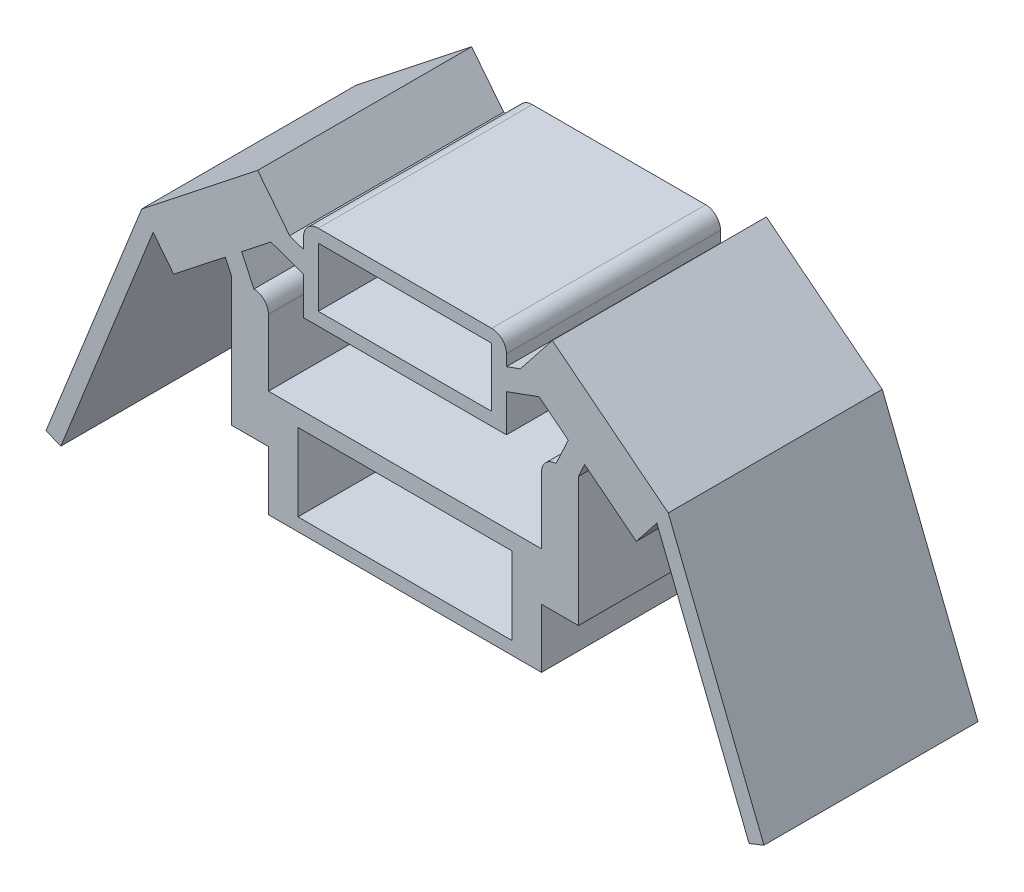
SolidWorks part; units mm, degrees
ref_plane "前视基准面" through (0, 0, 0) normal (0, 0, 1) x (1, 0, 0)
ref_plane "上视基准面" through (0, 0, 0) normal (0, 1, 0) x (1, 0, 0)
ref_plane "右视基准面" through (0, 0, 0) normal (1, 0, 0) x (0, 0, -1)
other "Configuration Table"
sketch "草图1" plane through (0, 0, 0) normal (0, 0, 1) x (1, 0, 0)
  line L0 (2.75, 5.2) -> (3.1259, 5.3368)
  line L1 (-3.7, -1.4) -> (3.7, -1.4)
  line L2 (-3.7, -1.4) -> (-3.7, 1.4)
  line L4 (3.7, -1.4) -> (3.7, 0.1)
  line L5 (-3.7, -1.4) -> (3.7, 1.4) construction
  line L6 (-3.7, 1.4) -> (3.7, -1.4) construction
  line L7 (-2.75, 5.2) -> (2.75, 5.2)
  line L8 (-2.75, 5.2) -> (-2.75, 3.6)
  line L9 (-2.75, 3.6) -> (2.75, 3.6)
  line L10 (2.75, 4.6147) -> (2.75, 3.6)
  line L11 (-2.75, 5.2) -> (2.75, 3.6) construction
  line L12 (-2.75, 3.6) -> (2.75, 5.2) construction
  line L14 (3.7, 0.1) -> (4.7, 0.1)
  line L17 (3.9926, 6.4362) -> (3.1259, 5.3368)
  line L19 (3.9926, 6.4362) -> (7.1338, 3.9598)
  line L33 (2.75, 5.2) -> (2.75, 4.6147) construction
  line L34 (3.1259, 5.3368) -> (3.6338, 4.9364) construction
  line L37 (4.7, 3.6) -> (4.7, 0.1)
  line L38 (-3.7, 1.4) -> (3.7, 1.4)
  line L39 (3.7, 1.4) -> (3.7, 0.1) construction
  line L40 (0, 9.062) -> (0, -4.0269) construction
  line L41 (2.75, 4.6147) -> (3.6338, 4.9364)
  line L48 (3.6338, 4.9364) -> (4.4253, 4.3124)
  line L51 (4.0931, 3.6) -> (4.4253, 4.3124)
  line L53 (4.869, 3.9625) -> (6.2671, 2.8603)
  line L55 (4.4253, 4.3124) -> (4.869, 3.9625) construction
  line L56 (4.0931, 3.6) -> (4.7, 3.6) construction
  line L57 (3.7, 1.4) -> (3.7, 3.6)
  line L58 (3.7, 3.6) -> (4.0931, 3.6)
  line L59 (4.7, 3.6) -> (4.869, 3.9625)
  line L60 (6.2671, 2.8603) -> (7.1338, 3.9598)
  point P0 (0, 0)
  point P6 (0, 4.4)
  dimension "D1" = 7.4
  dimension "D2" = 2.8
  dimension "D3" = 5.5
  dimension "D4" = 1.6
  dimension "D5" = 1
  dimension "D6" = 0.4
  dimension "D7" = 0.4
  dimension "D8" = 0.55
  dimension "D9" = 3.5
  dimension "D10" = 1.4
  dimension "D11" = 0.55
  dimension "D12" = 2.2
  dimension "D13" = 65
  dimension "D14" = 2.2
  dimension "D15" = 4
  dimension "D16" = 110
extrude "凸台-拉伸1" add sketch "草图1" along normal blind 5.8
mirror "镜向1" about plane through (0, 0, 0) normal (1, 0, 0) of "凸台-拉伸1"
sketch "草图10" plane through (0, 0, 5.8) normal (0, 0, 1) x (1, 0, 0)
  line L0 (-2.75, 3.6) -> (2.75, 3.6) construction
  line L1 (-2.9, -1.05) -> (2.9, -1.05)
  line L2 (-2.9, -1.05) -> (-2.9, 1.05)
  line L3 (-2.9, 1.05) -> (2.9, 1.05)
  line L4 (2.9, -1.05) -> (2.9, 1.05)
  line L5 (-2.9, -1.05) -> (2.9, 1.05) construction
  line L6 (-2.9, 1.05) -> (2.9, -1.05) construction
  line L7 (-2.35, 5.55) -> (2.35, 5.55)
  line L8 (-2.35, 5.55) -> (-2.35, 3.95)
  line L9 (-2.35, 3.95) -> (2.35, 3.95)
  line L10 (2.35, 5.55) -> (2.35, 3.95)
  point P0 (0, 0)
  point P10 (0, 5.55)
  dimension "D1" = 5.8
  dimension "D2" = 2.1
  dimension "D3" = 4.7
  dimension "D4" = 1.6
  dimension "D5" = 0.35
extrude "切除-拉伸3" cut sketch "草图10" against normal through all
sketch "草图11" plane through (0, 0, 5.8) normal (0, 0, 1) x (1, 0, 0)
  line L0 (-2.35, 5.2) -> (-2.75, 5.2)
  line L1 (-2.75, 5.2) -> (-2.75, 5.9)
  line L2 (-2.75, 5.9) -> (2.75, 5.9)
  line L3 (2.75, 5.9) -> (2.75, 5.2)
  line L4 (2.75, 3.6) -> (2.75, 4.6147) construction
  line L5 (2.75, 5.2) -> (2.35, 5.2)
  line L6 (2.35, 5.2) -> (2.35, 5.55)
  line L7 (2.35, 5.55) -> (-2.35, 5.55)
  line L8 (-2.35, 5.55) -> (-2.35, 5.2)
  line L9 (-2.35, 3.95) -> (2.35, 3.95) construction
  dimension "D1" = 0.35
  dimension "D2" = 1.6
extrude "凸台-拉伸2" add sketch "草图11" against normal up to surface (5.8 mm away)
fillet "圆角1" radius 0.4 2 edges at (-2.75, 5.9, 2.9) (2.75, 5.9, 2.9)
sketch "草图12" plane through (0, 0, 5.8) normal (0, 0, 1) x (1, 0, 0)
  line L0 (7.1338, 3.9598) -> (6.8243, 3.5671)
  line L1 (6.2671, 2.8603) -> (7.1338, 3.9598) construction
  line L2 (6.8243, 3.5671) -> (9.3254, -2.7024)
  line L3 (9.3254, -2.7024) -> (9.7276, -2.542)
  line L4 (9.7276, -2.542) -> (7.1338, 3.9598)
  line L5 (-7.1338, 3.9598) -> (-9.7276, -2.542)
  line L6 (-9.7276, -2.542) -> (-9.3254, -2.7024)
  line L7 (-9.3254, -2.7024) -> (-6.8243, 3.5671)
  line L8 (-6.2671, 2.8603) -> (-7.1338, 3.9598) construction
  line L9 (-6.8243, 3.5671) -> (-7.1338, 3.9598)
  dimension "D1" = 0.5
  dimension "D2" = 0.5
  dimension "D3" = 60
  dimension "D4" = 60
  dimension "D5" = 7
  dimension "D6" = 7
extrude "凸台-拉伸4" add sketch "草图12" against normal up to surface (5.8 mm away)
sketch "草图13" plane through (0, 0, 5.8) normal (0, 0, 1) x (1, 0, 0)
  line L0 (2.9, -1.05) -> (2.9, 1.05) construction
  line L1 (-2.9, 1.05) -> (2.9, 1.05)
  line L2 (-2.9, 1.05) -> (-2.9, 0.95)
  line L3 (-2.9, 0.95) -> (2.9, 0.95)
  line L4 (2.9, 1.05) -> (2.9, 0.95)
  line L5 (3.7, -1.4) -> (3.7, 0.1) construction
  line L6 (-3.7, -1.4) -> (3.7, -1.4)
  line L7 (-3.7, -1.4) -> (-3.7, -1.5)
  line L8 (-3.7, -1.5) -> (3.7, -1.5)
  line L9 (3.7, -1.4) -> (3.7, -1.5)
  dimension "D1" = 0.1
  dimension "D2" = 0.1
extrude "凸台-拉伸5" add sketch "草图13" against normal up to surface (5.8 mm away)
sketch "草图14" plane through (0, 0, 5.8) normal (0, 0, 1) x (1, 0, 0)
  line L0 (2.9, -1.05) -> (2.9, 0.95) construction
  line L1 (-2.9, -1.05) -> (2.9, -1.05)
  line L2 (-2.9, -1.05) -> (-2.9, -1.15)
  line L3 (-2.9, -1.15) -> (2.9, -1.15)
  line L4 (2.9, -1.05) -> (2.9, -1.15)
  dimension "D1" = 0.1
extrude "切除-拉伸4" cut sketch "草图14" against normal through all
fillet "圆角2" radius 0.4 2 edges at (3.7, 3.6, 2.9) (-3.7, 3.6, 2.9)
